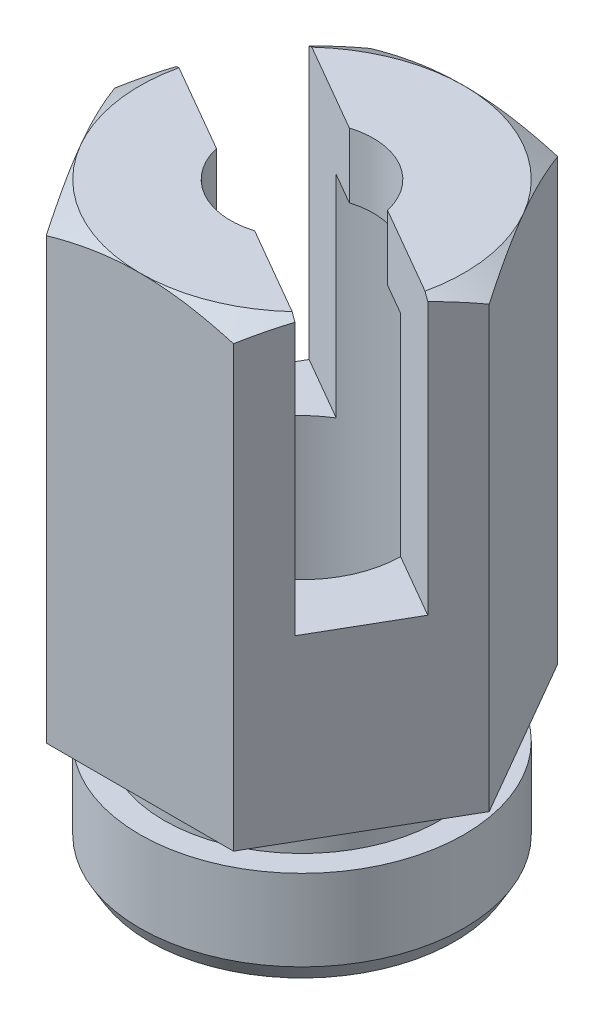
SolidWorks part; units mm, degrees
ref_plane "Plan de face" through (0, 0, 0) normal (0, 0, 1) x (1, 0, 0)
ref_plane "Plan de dessus" through (0, 0, 0) normal (0, 1, 0) x (1, 0, 0)
ref_plane "Plan de droite" through (0, 0, 0) normal (1, 0, 0) x (0, 0, -1)
sketch "Esquisse1" plane through (0, 0, 0) normal (0, 1, 0) x (1, 0, 0)
  line L1 (5.7735, 0) -> (2.8868, 5)
  line L2 (2.8868, 5) -> (-2.8868, 5)
  line L3 (-2.8868, 5) -> (-5.7735, 0)
  line L4 (-5.7735, 0) -> (-2.8868, -5)
  line L5 (-2.8868, -5) -> (2.8868, -5)
  line L6 (2.8868, -5) -> (5.7735, 0)
  circle A0 centre (0, 0) radius 5 construction
  dimension "D1" = 10
extrude "Boss.-Extru.1" add sketch "Esquisse1" along normal blind 14
sketch "Esquisse2" plane through (0, 0, 0) normal (1, 0, 0) x (0, 0, -1)
  line L0 (5, 14) -> (10, 14)
  line L1 (10, 14) -> (10, 11.1132)
  line L2 (10, 11.1132) -> (5, 14)
  line L3 (0, 17.861) -> (0, -4.1779) construction
  dimension "D1" = 30
  dimension "D2" = 5
revolve "Enlèvement de matière-Révolution1" cut sketch "Esquisse2" angle 360 about L3
sketch "Esquisse3" plane through (0, 0, 0) normal (0, -1, 0) x (1, 0, 0)
  circle A0 centre (0, 0) radius 4.25
  dimension "D1" = 8.5
extrude "Boss.-Extru.2" add sketch "Esquisse3" along normal blind 1
sketch "Esquisse4" plane through (0, -1, 0) normal (0, -1, 0) x (1, 0, 0)
  circle A0 centre (0, 0) radius 5
  dimension "D1" = 10
extrude "Boss.-Extru.3" add sketch "Esquisse4" along normal blind 3
chamfer "Chanfrein1" distance 0.5 angle 30 1 edges at (0, -4, -5)
sketch "Esquisse5" plane through (0, -4, 0) normal (0, -1, 0) x (1, 0, 0)
  circle A0 centre (0, 0) radius 3.1
  dimension "D1" = 6.2
extrude "Enlèv. mat.-Extru.1" cut sketch "Esquisse5" against normal blind 16
chamfer "Chanfrein2" distance 0.5 angle 30 1 edges at (0, -4, -3.1)
sketch "Esquisse6" plane through (4.3301, 0, 2.5) normal (0.866, 0, 0.5) x (0.5, 0, -0.866)
  line L0 (0, 14) -> (-4.3301, 14) construction
  line L1 (-1.5, 14) -> (1.5, 14)
  line L2 (-1.5, 14) -> (-1.5, 5.5)
  line L3 (-1.5, 5.5) -> (1.5, 5.5)
  line L4 (1.5, 14) -> (1.5, 5.5)
  line L5 (0, 0) -> (0, 14.3756) construction
  dimension "D1" = 3
  dimension "D2" = 8.5
extrude "Enlèv. mat.-Extru.2" cut sketch "Esquisse6" against normal through all
sketch "Esquisse7" plane through (0, 14, 0) normal (0, 1, 0) x (1, 0, 0)
  circle A0 centre (0, 0) radius 2.2
  dimension "D1" = 4.4
extrude "Enlèv. mat.-Extru.3" cut sketch "Esquisse7" against normal through all
